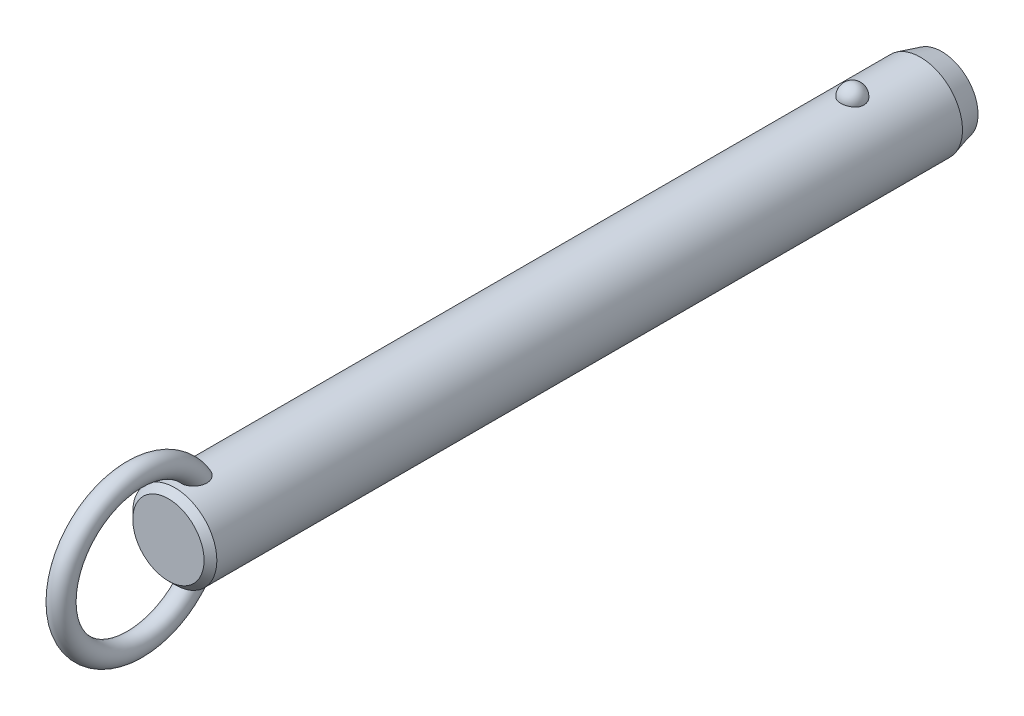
SolidWorks part; units mm, degrees
ref_plane "Front Plane" through (0, 0, 0) normal (0, 0, 1) x (1, 0, 0)
ref_plane "Top Plane" through (0, 0, 0) normal (0, 1, 0) x (1, 0, 0)
ref_plane "Right Plane" through (0, 0, 0) normal (1, 0, 0) x (0, 0, -1)
sketch "Sketch2" plane through (0, 0, 0) normal (0, 0, 1) x (1, 0, 0)
  circle A0 centre (0, 0) radius 7.9
  point P3 (0, 7.9)
  dimension "D1" = 15.8
extrude "Boss-Extrude1" add sketch "Sketch2" along normal blind 116.8
sketch "Sketch3" plane through (0, 0, 0) normal (0, 0, -1) x (-1, 0, 0)
  circle A0 centre (0, 0) radius 7.9
  dimension "D1" = 15.8
extrude "Boss-Extrude2" add sketch "Sketch3" along normal blind 19
chamfer "Chamfer1" distance 4 angle 15 1 edges at (-7.9, 0, -19)
sketch "Sketch12" plane through (0, 0, 0) normal (1, 0, 0) x (0, 0, -1)
  line L0 (-116.8, 7.9) -> (-116.8, -7.9) construction
  point P0 (-116.8, 0)
sketch "Sketch13" plane through (0, 0, 0) normal (1, 0, 0) x (0, 0, -1)
  circle A0 centre (-132.65, 0) radius 15.85
  point P2 (-116.8, 0)
  dimension "D1" = 31.7
sketch "Sketch14" plane through (0, 0, 0) normal (0, 1, 0) x (1, 0, 0)
  circle A0 centre (0, -118.8) radius 2
  point P2 (0, -116.8)
  dimension "D1" = 4
sweep "Sweep1" add profiles "Sketch14" path "Sketch13"
sketch "Sketch15" plane through (0, 0, 116.8) normal (0, 0, 1) x (1, 0, 0)
  circle A0 centre (0, 0) radius 7.9
  dimension "D1" = 15.8
extrude "Boss-Extrude3" add sketch "Sketch15" along normal blind 9.52
chamfer "Chamfer2" distance 1.2 angle 45 1 edges at (7.9, 0, 126.32)
sketch "Sketch18" plane through (0, 0, 0) normal (1, 0, 0) x (0, 0, -1)
  line L0 (15, 7.9) -> (-118.9091, 7.9) construction
  line L1 (2.2, 10.1) -> (2.2, 5.7)
  line L2 (-118.9091, -7.9) -> (15, -7.9) construction
  arc A0 (2.2, 10.1) -> (2.2, 5.7) centre (2.2, 7.9) ccw
  point P4 (0, 7.9)
  dimension "D1" = 18
revolve "Revolve1" add sketch "Sketch18" angle 360 about L1
